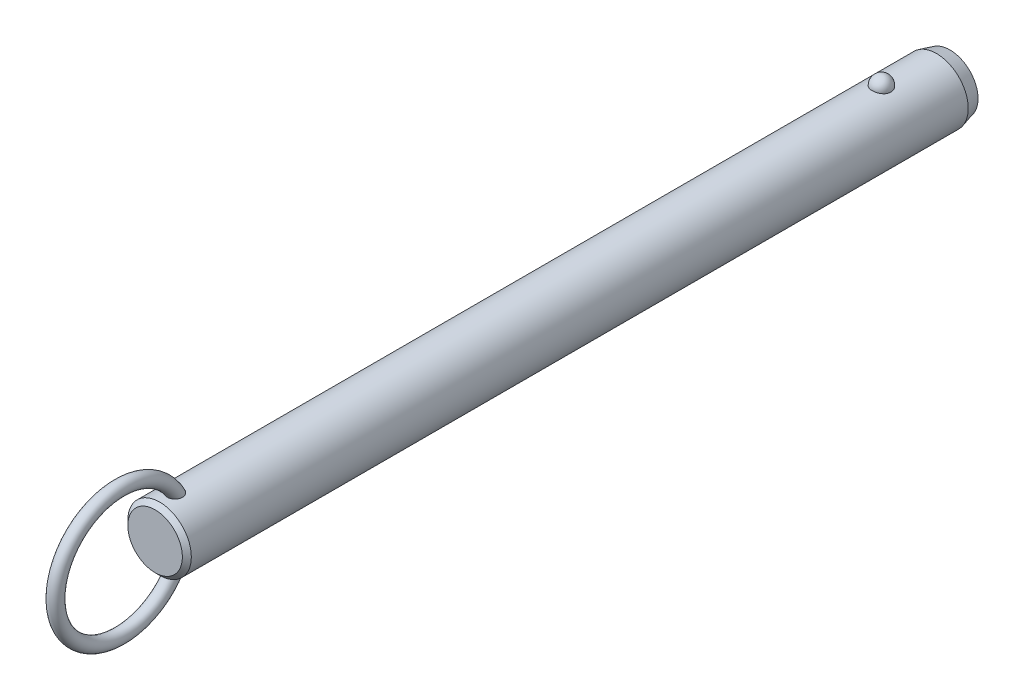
SolidWorks part; units mm, degrees
ref_plane "Front Plane" through (0, 0, 0) normal (0, 0, 1) x (1, 0, 0)
ref_plane "Top Plane" through (0, 0, 0) normal (0, 1, 0) x (1, 0, 0)
ref_plane "Right Plane" through (0, 0, 0) normal (1, 0, 0) x (0, 0, -1)
sketch "Sketch2" plane through (0, 0, 0) normal (0, 0, 1) x (1, 0, 0)
  circle A0 centre (0, 0) radius 7.1
  point P3 (0, 7.1)
  dimension "D1" = 14.2
extrude "Boss-Extrude1" add sketch "Sketch2" along normal blind 152.4
sketch "Sketch3" plane through (0, 0, 0) normal (0, 0, -1) x (-1, 0, 0)
  circle A0 centre (0, 0) radius 7.1
  dimension "D1" = 14.2
extrude "Boss-Extrude2" add sketch "Sketch3" along normal blind 17.4
chamfer "Chamfer1" distance 3 angle 15 1 edges at (-7.1, 0, -17.4)
sketch "Sketch12" plane through (0, 0, 0) normal (1, 0, 0) x (0, 0, -1)
  line L0 (-152.4, 7.1) -> (-152.4, -7.1) construction
  point P0 (-152.4, 0)
sketch "Sketch13" plane through (0, 0, 0) normal (1, 0, 0) x (0, 0, -1)
  circle A0 centre (-168.25, 0) radius 15.85
  point P2 (-152.4, 0)
  dimension "D1" = 31.7
sketch "Sketch14" plane through (0, 0, 0) normal (0, 1, 0) x (1, 0, 0)
  circle A0 centre (0, -153.9) radius 1.5
  point P2 (0, -152.4)
  dimension "D1" = 3
sweep "Sweep1" add profiles "Sketch14" path "Sketch13"
sketch "Sketch15" plane through (0, 0, 152.4) normal (0, 0, 1) x (1, 0, 0)
  circle A0 centre (0, 0) radius 7.1
  dimension "D1" = 14.2
extrude "Boss-Extrude3" add sketch "Sketch15" along normal blind 7.92
chamfer "Chamfer2" distance 1 angle 45 1 edges at (7.1, 0, 160.32)
sketch "Sketch18" plane through (0, 0, 0) normal (1, 0, 0) x (0, 0, -1)
  line L0 (14.4, 7.1) -> (-154.0792, 7.1) construction
  line L1 (2.1, 9.2) -> (2.1, 5)
  line L2 (-154.0792, -7.1) -> (14.4, -7.1) construction
  arc A0 (2.1, 9.2) -> (2.1, 5) centre (2.1, 7.1) ccw
  point P4 (0, 7.1)
  dimension "D1" = 16.3
revolve "Revolve1" add sketch "Sketch18" angle 360 about L1
